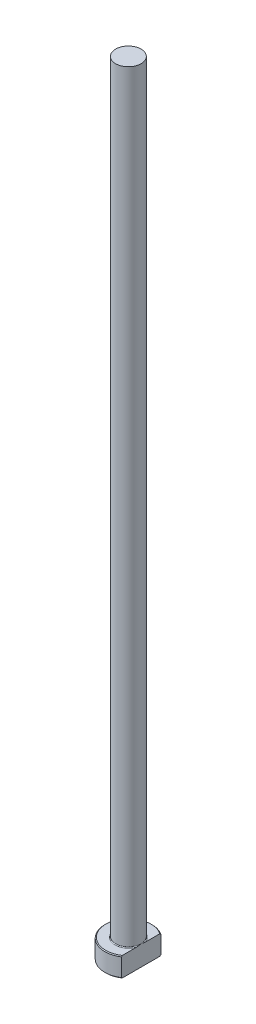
SolidWorks part; units mm, degrees
ref_plane "Front Plane" through (0, 0, 0) normal (0, 0, 1) x (1, 0, 0)
ref_plane "Top Plane" through (0, 0, 0) normal (0, 1, 0) x (1, 0, 0)
ref_plane "Right Plane" through (0, 0, 0) normal (1, 0, 0) x (0, 0, -1)
sketch "Sketch1" plane through (0, 0, 0) normal (0, 0, 1) x (1, 0, 0)
  line L0 (0, 259.9588) -> (0, -15.1925) construction
  line L1 (0, 0) -> (-6, 0)
  line L2 (-6, 0) -> (-6, 5)
  line L3 (-6, 5) -> (-3.25, 5)
  line L4 (-3.25, 5) -> (-3.25, 200)
  line L5 (-3.25, 200) -> (0, 200)
  line L6 (0, 200) -> (0, 0)
  dimension "L" = 200
  dimension "H" = 12
  dimension "T" = 5
  dimension "D" = 6.5
revolve "Revolve1" add sketch "Sketch1" angle 360 about L0
chamfer "Chamfer1" distance 0.2 angle 45 2 edges at (0, 5, 6) (0, 0, 6)
fillet "Fillet1" radius 0.2 1 edges at (0, 5, 3.25)
sketch "Sketch2" plane through (0, 0, 0) normal (0, 1, 0) x (1, 0, 0)
  line L0 (3.25, 5.0436) -> (3.25, -5.0436)
  circle A0 centre (0, 0) radius 6 construction
  arc A1 (3.25, -5.0436) -> (3.25, 5.0436) centre (0, 0) ccw
  circle A2 centre (0, 0) radius 3.25 construction
extrude "KEY" cut sketch "Sketch2" along normal through all
